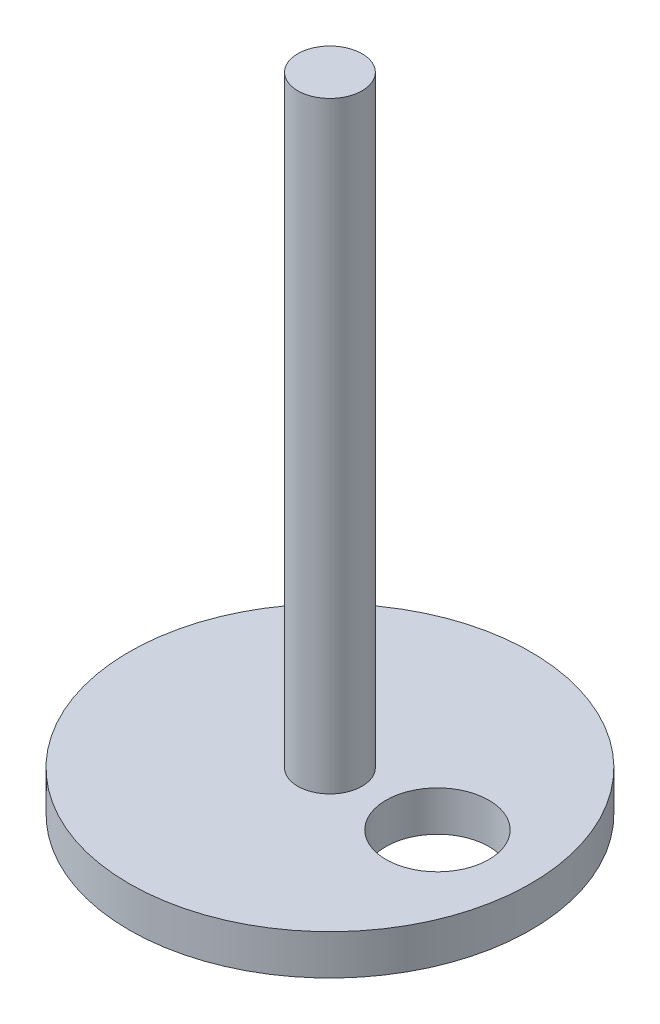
SolidWorks part; units mm, degrees
ref_plane "Front Plane" through (0, 0, 0) normal (0, 0, 1) x (1, 0, 0)
ref_plane "Top Plane" through (0, 0, 0) normal (0, 1, 0) x (1, 0, 0)
ref_plane "Right Plane" through (0, 0, 0) normal (1, 0, 0) x (0, 0, -1)
sketch "Sketch1" plane through (0, 0, 0) normal (0, 1, 0) x (1, 0, 0)
  circle A0 centre (0, 0) radius 50
  dimension "D1" = 100
extrude "Boss-Extrude1" add sketch "Sketch1" along normal blind 10
sketch "Sketch2" plane through (0, 10, 0) normal (0, 1, 0) x (1, 0, 0)
  circle A0 centre (0, 0) radius 8
  dimension "D1" = 16
extrude "Boss-Extrude2" add sketch "Sketch2" along normal blind 150
sketch "Sketch3" plane through (0, 0, 0) normal (0, -1, 0) x (1, 0, 0)
  circle A0 centre (26.7753, 0) radius 12.8071
extrude "Cut-Extrude1" cut sketch "Sketch3" against normal blind 10
